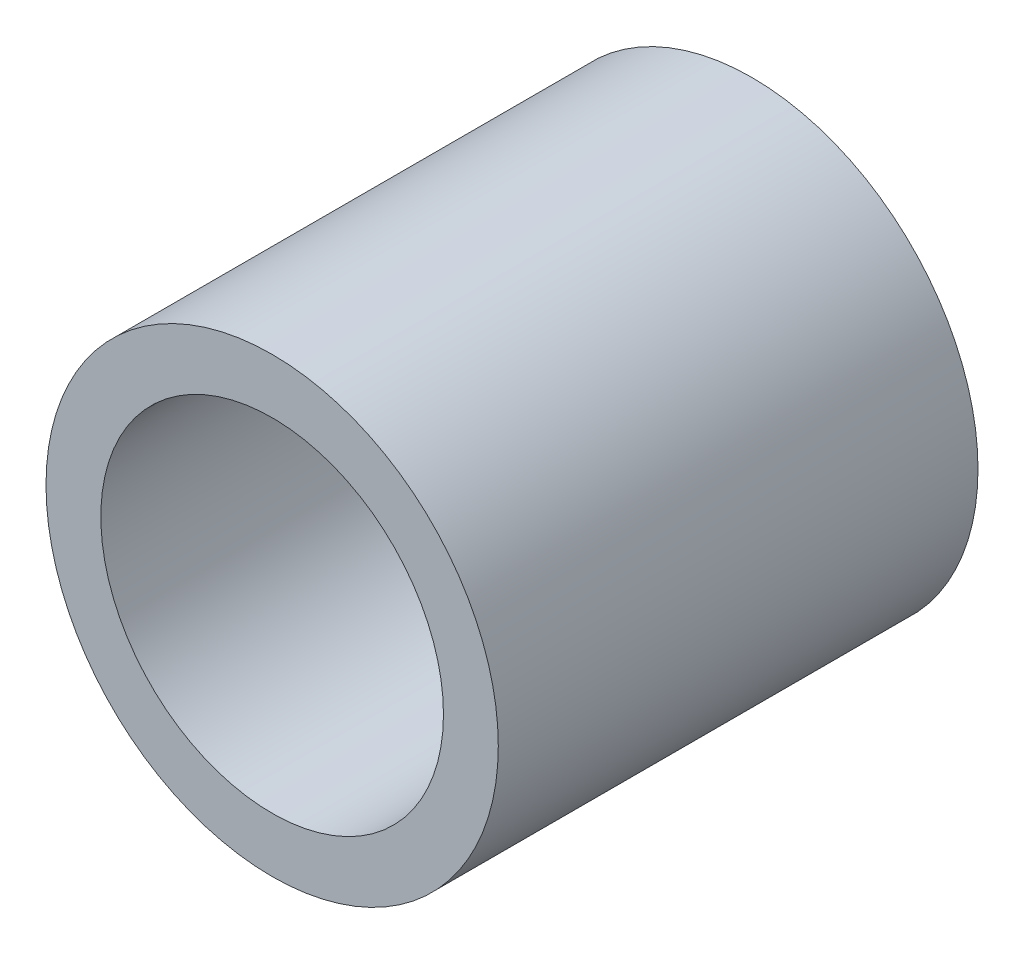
SolidWorks part; units mm, degrees
ref_plane "Plan de face" through (0, 0, 0) normal (0, 0, 1) x (1, 0, 0)
ref_plane "Plan de dessus" through (0, 0, 0) normal (0, 1, 0) x (1, 0, 0)
ref_plane "Plan de droite" through (0, 0, 0) normal (1, 0, 0) x (0, 0, -1)
sketch "Esquisse1" plane through (0, 0, 0) normal (0, 0, 1) x (1, 0, 0)
  circle A0 centre (0, 0) radius 12.5
  circle A1 centre (0, 0) radius 16.5
  dimension "D2" = 33
  dimension "D1" = 25
extrude "Extrusion1" add sketch "Esquisse1" along normal blind 35
